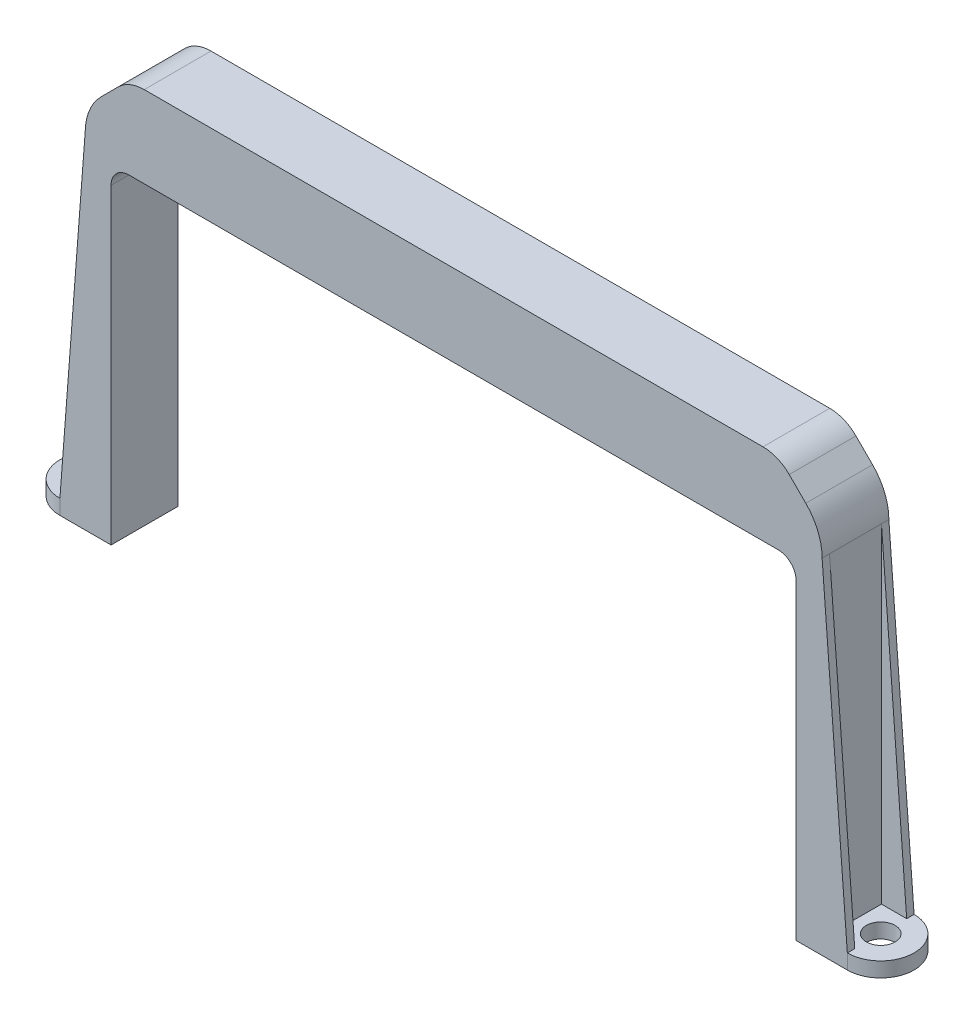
SolidWorks part; units mm, degrees
ref_plane "Front Plane" through (0, 0, 0) normal (0, 0, 1) x (1, 0, 0)
ref_plane "Top Plane" through (0, 0, 0) normal (0, 1, 0) x (1, 0, 0)
ref_plane "Right Plane" through (0, 0, 0) normal (1, 0, 0) x (0, 0, -1)
sketch "Sketch1" plane through (0, 0, 0) normal (0, 0, 1) x (1, 0, 0)
  line L0 (55.6006, 0) -> (-55.6006, 0)
  line L1 (-55.6006, 0) -> (-55.6006, 3.81)
  line L2 (-55.6006, 3.81) -> (55.6006, 3.81)
  line L3 (55.6006, 0) -> (55.6006, 3.81)
  line L7 (0, 0) -> (0, 17.3376) construction
  point P5 (0, 3.81)
  dimension "D1" = 3.81
  dimension "D2" = 111.2012
extrude "Boss-Extrude1" add sketch "Sketch1" along normal blind 11.43
sketch "Sketch2" plane through (0, 0, 0) normal (0, 0, -1) x (-1, 0, 0)
  line L0 (55.6006, 0) -> (-55.6006, 0) construction
  line L1 (-55.6006, 0) -> (-51.7906, 0)
  line L2 (-55.6006, 0) -> (-55.6006, -10.16)
  line L3 (-55.6006, -10.16) -> (-52.6413, -10.16)
  line L4 (-52.6413, -10.16) -> (-51.7906, -6.985)
  line L5 (-50.8, -19.05) -> (-50.8, 8.9171) construction
  line L6 (-51.7906, 0) -> (-51.7906, -6.985)
  line L7 (-49.8094, 0) -> (-49.8094, -6.985)
  line L8 (-48.9587, -10.16) -> (-49.8094, -6.985)
  line L9 (-45.9994, -10.16) -> (-48.9587, -10.16)
  line L10 (-45.9994, 0) -> (-45.9994, -10.16)
  line L11 (-45.9994, 0) -> (-49.8094, 0)
  line L14 (-55.6006, 0) -> (-55.6006, 3.81) construction
  dimension "D1" = 10.16
  dimension "D2" = 105
  dimension "D3" = 3.175
  dimension "D4" = 3.81
  dimension "D5" = 1.9812
  dimension "D6" = 9.6012
extrude "Boss-Extrude2" add sketch "Sketch2" against normal up to surface (11.43 mm away)
pattern_linear "LPattern1" count 6 spacing 20.32 along (-1, 0, 0) of "Boss-Extrude2"
ref_plane "Plane1" through (0, 0, 0) normal (1, 0, 0) x (0, 0, -1)
sketch "Sketch3" plane through (0, 0, 11.43) normal (0, 0, 1) x (1, 0, 0)
  line L0 (45.9994, -10.16) -> (48.9587, -10.16) construction
  line L1 (55.6006, -10.16) -> (-55.6006, -10.16)
  line L2 (55.6006, -10.16) -> (55.6006, 0)
  line L3 (55.6006, 0) -> (-55.6006, 0)
  line L4 (-55.6006, -10.16) -> (-55.6006, 0)
  line L5 (-55.6006, 3.81) -> (-55.6006, -10.16) construction
  line L6 (49.8094, 0) -> (51.7906, 0) construction
extrude "Boss-Extrude3" add sketch "Sketch3" against normal blind 2.54
sketch "Sketch4" plane through (0, 0, 11.43) normal (0, 0, 1) x (1, 0, 0)
  line L1 (58.6486, -13.208) -> (58.6486, -66.5594)
  line L2 (55.6006, 3.81) -> (60.3038, -0.8932)
  line L3 (58.6486, -66.5594) -> (63.0936, -66.5594)
  line L4 (-55.6006, -10.16) -> (55.6006, -10.16) construction
  line L5 (-76.2, -66.5594) -> (76.2, -66.5594) construction
  line L7 (63.0936, -66.5594) -> (63.0936, -7.6284)
  line L9 (55.6006, 3.81) -> (55.6006, -10.16)
  arc A0 (58.6486, -13.208) -> (55.6006, -10.16) centre (55.6006, -13.208) ccw
  arc A1 (63.0936, -7.6284) -> (60.3038, -0.8932) centre (53.5686, -7.6284) ccw
  dimension "D1" = 3.048
  dimension "D2" = 4.445
  dimension "D4" = 9.525
  dimension "D3" = 45
extrude "Boss-Extrude4" add sketch "Sketch4" against normal up to surface (11.43 mm away)
sketch "Sketch5" plane through (0, -66.5594, 0) normal (0, -1, 0) x (1, 0, 0)
  line L0 (63.0936, 0) -> (67.4116, 0)
  line L1 (67.4116, 11.43) -> (63.0936, 11.43)
  line L2 (63.0936, 0) -> (63.0936, 11.43) construction
  line L3 (67.4116, 5.715) -> (55.6006, 5.715) construction
  line L4 (55.6006, 11.43) -> (55.6006, 0) construction
  line L6 (63.0936, 11.43) -> (63.0936, 0)
  arc A0 (67.4116, 0) -> (67.4116, 11.43) centre (67.4116, 5.715) ccw
  circle A1 centre (67.4116, 5.715) radius 2.4638
  dimension "D1" = 4.9276
  dimension "D2" = 4.318
extrude "Boss-Extrude5" add sketch "Sketch5" against normal blind 2.54
sketch "Sketch6" plane through (0, 0, 0) normal (0, 0, -1) x (-1, 0, 0)
  line L0 (-63.0936, -7.6284) -> (-67.4116, -64.0194)
  line L1 (-67.4116, -64.0194) -> (-63.0936, -64.0194)
  line L2 (-63.0936, -64.0194) -> (-63.0936, -7.6284)
extrude "Boss-Extrude6" add sketch "Sketch6" against normal blind 1.27
sketch "Sketch7" plane through (0, 0, 11.43) normal (0, 0, 1) x (1, 0, 0)
  line L0 (63.0936, -7.6284) -> (63.0936, -64.0194)
  line L1 (63.0936, -64.0194) -> (67.4116, -64.0194)
  line L2 (67.4116, -64.0194) -> (63.0936, -64.0194) construction
  line L3 (67.4116, -64.0194) -> (63.0936, -7.6284)
extrude "Boss-Extrude7" add sketch "Sketch7" against normal blind 1.27
mirror "Mirror1" about plane through (0, 0, 0) normal (1, 0, 0) of "Boss-Extrude4", "Boss-Extrude5", "Boss-Extrude6", "Boss-Extrude7"
fillet "Fillet1" radius 6.35 2 edges at (-55.6006, 3.81, 5.715) (55.6006, 3.81, 5.715)
